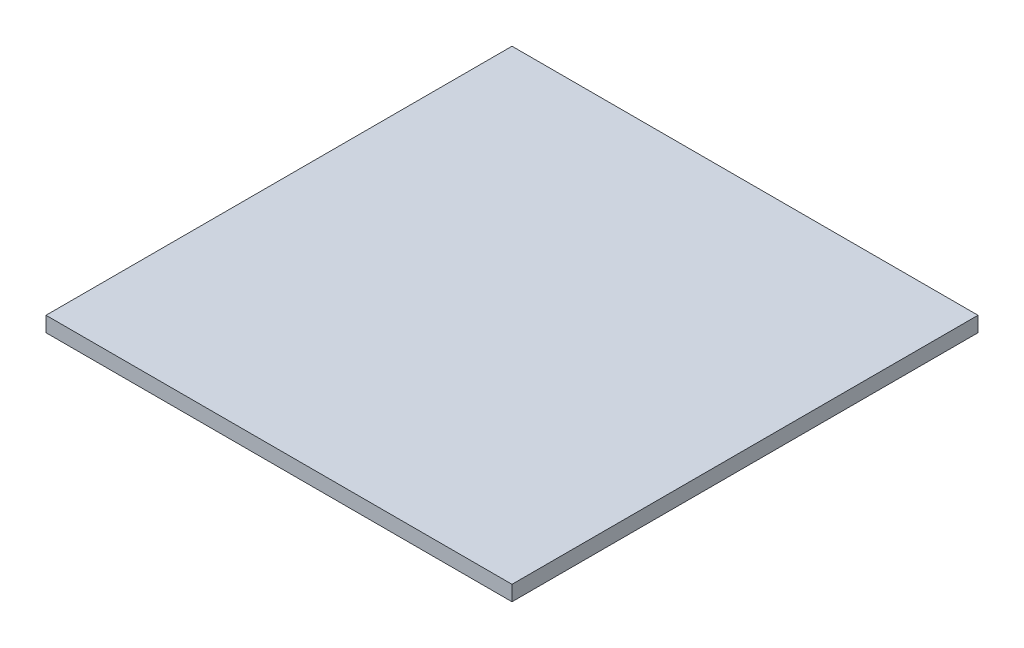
SolidWorks part; units mm, degrees
ref_plane "前视基准面" through (0, 0, 0) normal (0, 0, 1) x (1, 0, 0)
ref_plane "上视基准面" through (0, 0, 0) normal (0, 1, 0) x (1, 0, 0)
ref_plane "右视基准面" through (0, 0, 0) normal (1, 0, 0) x (0, 0, -1)
sketch "草图1" plane through (0, 0, 0) normal (0, 1, 0) x (1, 0, 0)
  line L1 (-29.7581, 35.9386) -> (31.7419, 35.9386)
  line L2 (-29.7581, 35.9386) -> (-29.7581, -25.5614)
  line L3 (-29.7581, -25.5614) -> (31.7419, -25.5614)
  line L4 (31.7419, 35.9386) -> (31.7419, -25.5614)
  dimension "D1" = 61.5
  dimension "D2" = 61.5
extrude "凸台-拉伸1" add sketch "草图1" along normal blind 2
